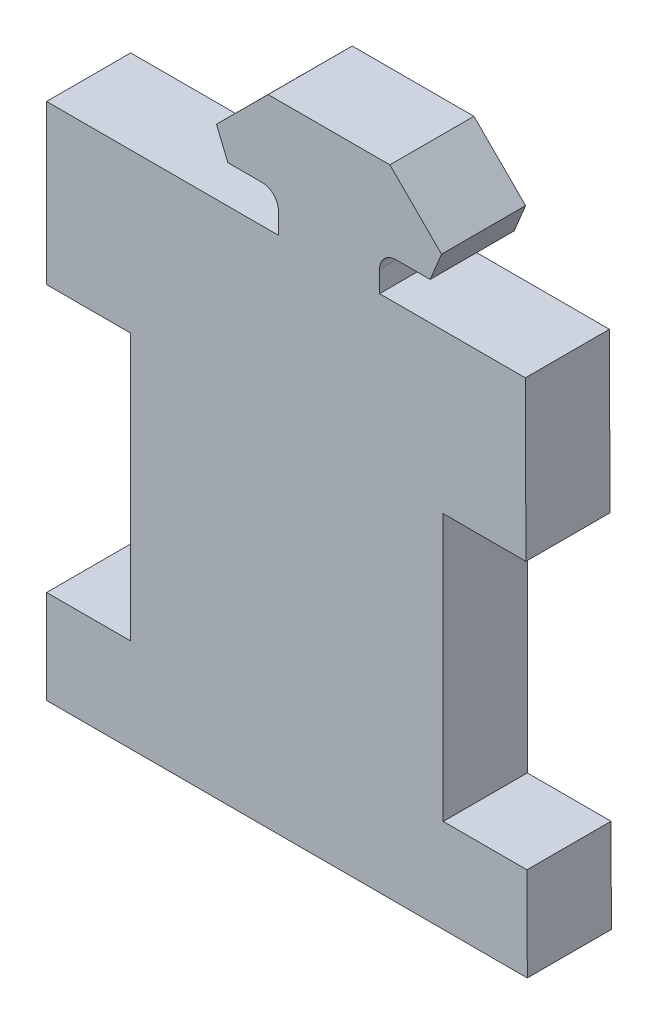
SolidWorks part; units mm, degrees
ref_plane "Front Plane" through (0, 0, 0) normal (0, 0, 1) x (1, 0, 0)
ref_plane "Top Plane" through (0, 0, 0) normal (0, 1, 0) x (1, 0, 0)
ref_plane "Right Plane" through (0, 0, 0) normal (1, 0, 0) x (0, 0, -1)
sketch "Sketch1" plane through (0, 0, 0) normal (0, 0, 1) x (1, 0, 0)
  line L0 (-444.7212, -726.2003) -> (-446.9104, -726.2003)
  line L1 (-446.9104, -726.2003) -> (-447.6407, -724.4345)
  line L2 (-447.6407, -724.4345) -> (-444.3319, -721.1333)
  line L3 (-444.3319, -721.1333) -> (-436.5354, -721.1333)
  line L4 (-427.7337, -761.8323) -> (-427.8607, -728.41)
  line L5 (-437.1952, -727.2493) -> (-437.1952, -728.4101)
  line L6 (-433.2266, -724.4345) -> (-436.5354, -721.1333)
  line L7 (-458.5185, -728.41) -> (-443.6722, -728.4101)
  line L8 (-443.6722, -727.2493) -> (-443.6722, -728.4101)
  line L9 (-433.9569, -726.2003) -> (-433.2266, -724.4345)
  line L10 (-437.1952, -728.4101) -> (-427.8607, -728.41)
  line L12 (-427.7337, -761.8323) -> (-458.5185, -761.8323)
  line L13 (-458.5185, -728.41) -> (-458.5185, -761.8323)
  line L14 (-436.1461, -726.2003) -> (-433.9569, -726.2003)
  arc A0 (-444.7212, -726.2003) -> (-443.6722, -727.2493) centre (-444.7212, -727.2493) cw
  arc A1 (-436.1461, -726.2003) -> (-437.1952, -727.2493) centre (-436.1461, -727.2493) ccw
  dimension "D1" = 30.7848
extrude "Boss-Extrude1" add sketch "Sketch1" along normal blind 5.3848 contours L7 L8 A0 L0 L1 L2 L3 L6 L9 L14 A1 L5 L10 L4 L12 L13
sketch "Sketch2" plane through (0, 0, 0) normal (0, 0, -1) x (-1, 0, 0)
  line L1 (437.1952, -728.1627) -> (427.8607, -728.1005)
  line L2 (427.8607, -728.1005) -> (427.6134, -728.1005)
  line L3 (427.8607, -728.6084) -> (437.1952, -728.6085)
  line L4 (437.1952, -727.2493) -> (437.1952, -728.4101) construction
  line L6 (458.5185, -728.41) -> (458.5185, -761.8323) construction
  line L7 (458.5185, -728.6085) -> (443.6722, -728.6085)
  line L8 (458.5185, -728.6085) -> (458.5185, -728.1039)
  line L9 (458.5185, -728.1039) -> (443.6722, -728.1039)
  line L10 (443.6722, -727.2493) -> (443.6722, -728.4101) construction
  line L11 (458.5185, -728.6085) -> (453.1337, -728.6085) construction
  line L12 (427.7337, -755.8421) -> (433.1185, -755.8421)
  line L13 (427.6134, -728.1005) -> (427.6134, -728.6084)
  line L14 (427.7337, -755.8421) -> (427.7337, -738.7685)
  line L15 (433.1185, -755.8421) -> (433.1185, -738.7685)
  line L16 (433.1185, -738.7685) -> (427.7337, -738.7685)
  line L17 (427.6134, -728.6084) -> (427.8607, -728.6084)
  line L22 (443.6722, -728.1039) -> (443.6722, -728.6085)
  line L24 (453.1337, -755.8421) -> (453.1337, -738.7685)
  line L25 (453.1337, -738.7685) -> (458.5185, -738.7685)
  line L26 (458.5185, -738.7685) -> (458.5185, -755.8421)
  line L27 (458.5185, -755.8421) -> (453.1337, -755.8421)
  line L28 (437.1952, -728.1627) -> (437.1952, -728.6085)
  dimension "D1" = 5.3848
extrude "Cut-Extrude1" cut sketch "Sketch2" against normal up to surface (5.3848 mm away)
